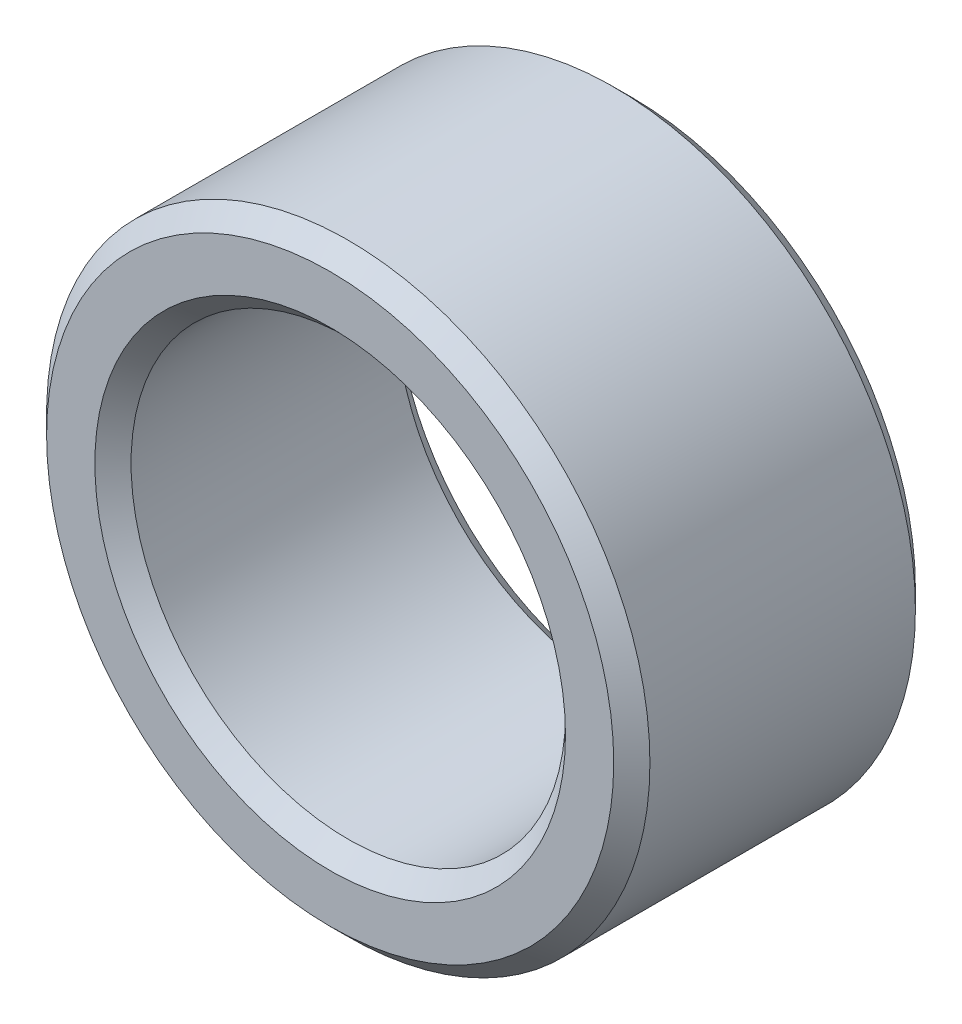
SolidWorks part; units mm, degrees
ref_plane "Front Plane" through (0, 0, 0) normal (0, 0, 1) x (1, 0, 0)
ref_plane "Top Plane" through (0, 0, 0) normal (0, 1, 0) x (1, 0, 0)
ref_plane "Right Plane" through (0, 0, 0) normal (1, 0, 0) x (0, 0, -1)
sketch "Sketch1" plane through (0, 0, 0) normal (0, 0, 1) x (1, 0, 0)
  circle A0 centre (0, 0) radius 1.5875
  circle A1 centre (0, 0) radius 1.143
sketch "Sketch2" plane through (0, 0, 0) normal (1, 0, 0) x (0, 0, -1)
  line L0 (-0.7938, 0) -> (0.7938, 0) construction
  point P0 (0.7937, 1.5875)
  point P3 (0, 0)
  point P6 (-0.7938, 1.5875)
  point P7 (0, 1.5875)
  dimension "Length" = 1.5875
sketch "Sketch3" plane through (0, 0, 0) normal (0, 0, 1) x (1, 0, 0)
  circle A0 centre (0, 0) radius 1.5875 construction
  circle A1 centre (0, 0) radius 1.143 construction
  circle A2 centre (0, 0) radius 1.5875
  circle A3 centre (0, 0) radius 1.143
extrude "Boss-Extrude1" add sketch "Sketch3" against normal up to vertex (0.7937 mm away) and the other way up to vertex (0.7937 mm away)
chamfer "Chamfer1" distance 0.0953 angle 45 4 edges at (1.5875, 0, -0.7938) (1.5875, 0, 0.7938) (1.143, 0, -0.7938) (1.143, 0, 0.7938)
sketch "Sketch4" plane through (0, 0, 0) normal (1, 0, 0) x (0, 0, -1)
  line L0 (0.6985, 1.143) -> (-0.6985, 1.143)
  line L1 (-0.6985, -1.143) -> (0.6985, -1.143)
  line L2 (-0.6985, -1.143) -> (0.6985, -1.143)
  line L3 (0.6985, 1.143) -> (-0.6985, 1.143)
equation "\"D1@Chamfer1\"=\"OD@Sketch1\"*.03"
